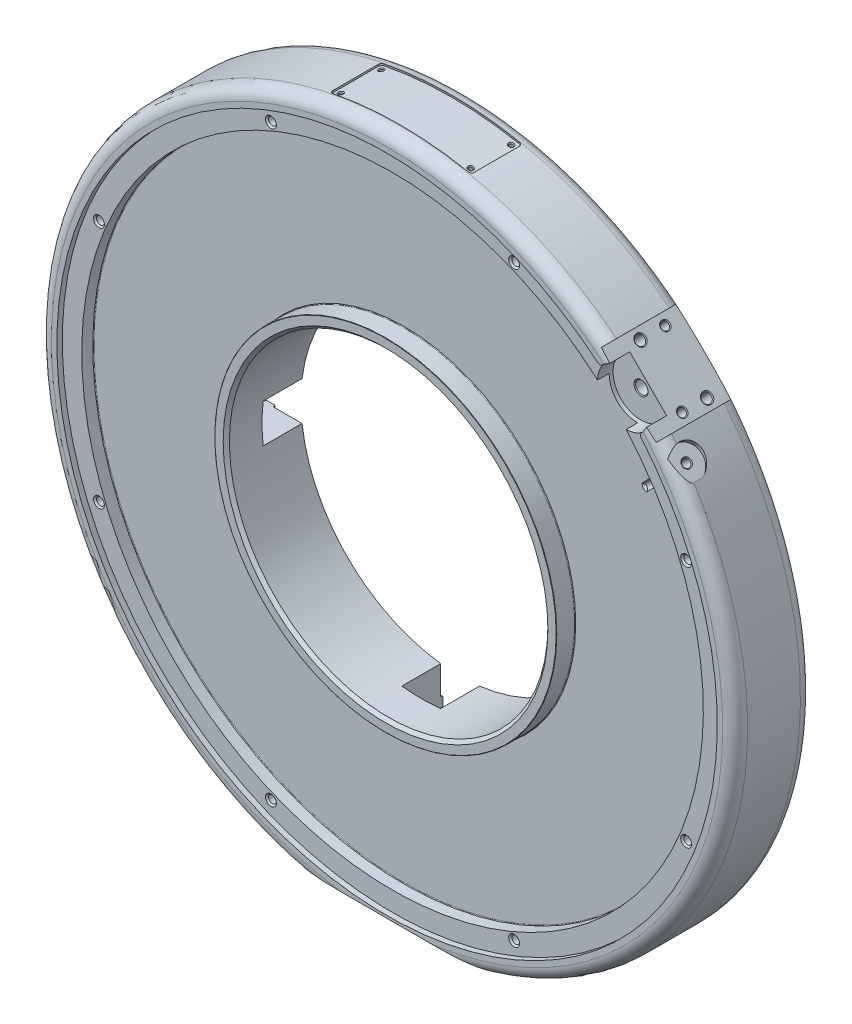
SolidWorks part; units mm, degrees
ref_plane "Plan de face" through (0, 0, 0) normal (0, 0, 1) x (1, 0, 0)
ref_plane "Plan de dessus" through (0, 0, 0) normal (0, 1, 0) x (1, 0, 0)
ref_plane "Plan de droite" through (0, 0, 0) normal (1, 0, 0) x (0, 0, -1)
sketch "Esquisse1" plane through (0, 0, 0) normal (0, 0, 1) x (1, 0, 0)
  circle A0 centre (0, 0) radius 224
  circle A1 centre (0, 0) radius 102.5
  dimension "D1" = 448
  dimension "D2" = 205
extrude "Extrusion1" add sketch "Esquisse1" along normal mid plane 50
sketch "Esquisse2" plane through (0, 0, 25) normal (0, 0, 1) x (1, 0, 0)
  line L0 (0, 0) -> (0, -139.6271) construction
  line L1 (224, -224) -> (-224, -224)
  line L2 (224, -224) -> (224, -214)
  line L3 (224, -214) -> (-224, -214)
  line L4 (-224, -224) -> (-224, -214)
  circle A1 centre (0, 0) radius 224 construction
  dimension "D1" = 10
extrude "Extrusion2" cut sketch "Esquisse2" against normal through all
sketch "Esquisse3" plane through (0, 0, -25) normal (0, 0, -1) x (-1, 0, 0)
  circle A0 centre (0, 0) radius 121
  dimension "D1" = 242
extrude "Extrusion3" cut sketch "Esquisse3" against normal blind 3
sketch "Esquisse4" plane through (0, 0, -25) normal (0, 0, -1) x (-1, 0, 0)
  line L1 (12.5, 0) -> (-12.5, 0)
  line L2 (12.5, 0) -> (12.5, 209)
  line L3 (12.5, 209) -> (-12.5, 209)
  line L4 (-12.5, 0) -> (-12.5, 209)
  dimension "D1" = 25
  dimension "D2" = 209
extrude "Extrusion4" cut sketch "Esquisse4" against normal blind 28
sketch "Esquisse5" plane through (0, 0, -25) normal (0, 0, -1) x (-1, 0, 0)
  line L0 (-12.5, 209) -> (-12.5, 120.3526) construction
  line L1 (12.5, 120.3526) -> (12.5, 209) construction
  line L2 (-12.5, 209) -> (-12.5, 101.7349) construction
  line L3 (12.5, 193) -> (12.5, 209)
  line L4 (-12.5, 209) -> (-12.5, 193)
  arc A0 (-12.5, 209) -> (-12.5, 193) centre (-12.5, 201) ccw
  arc A1 (12.5, 193) -> (12.5, 209) centre (12.5, 201) ccw
  dimension "D1" = 16
extrude "Extrusion5" cut sketch "Esquisse5" against normal up to surface (28 mm away)
pattern_circular "Répétition circulaire1" count 4 over 360 about axis through (0, 0, 0) along (0, 0, 1) of "Extrusion4", "Extrusion5"
hole_wizard "Diamètre du perçage Ø5.0 (5)1" positions "Esquisse7" profile "Esquisse6" hole size "Ø5.0" standard "ISO"
sketch "Esquisse7" plane through (0, 0, -22) normal (0, 0, -1) x (-1, 0, 0)
  line L0 (0, 0) -> (0, 236.799) construction
  line L1 (0, 0) -> (25.107, 113.2503) construction
  circle A0 centre (0, 0) radius 116 construction
  point P0 (25.107, 113.2503)
  point P12 (-25.107, 113.2503)
  dimension "D2" = 232
  dimension "D1" = 12.5
sketch "Esquisse6" plane through (-25.107, 113.2503, -22) normal (1, 0, 0) x (0, 1, 0)
  line L0 (0, 0) -> (0, 20.5022)
  line L1 (0, 20.5022) -> (2.5, 19)
  line L2 (2.5, 19) -> (2.5, 0)
  line L5 (2.5, 0) -> (0, 0)
  line L10 (0, 20.5022) -> (-2.5, 19) construction
  line L11 (0, -6.35) -> (0, 107.95) construction
  dimension "Diamètre du perçage" = 5
  dimension "Profondeur du perçage" = 19
  dimension "Angle de pointe" = 118
chamfer "Chanfrein2" distance 1 angle 45 2 edges at (-27.607, 113.2503, -22) (22.607, 113.2503, -22)
thread "Filetage1" pitch 1 start angle 0, offset 4, length 19, pitch 1, diameter 5
ref_plane "Plan2" through (-22.607, 113.2503, -25) normal (0, -1, 0) x (1, 0, 0)
sketch "Profil de filetage1" plane through (-22.607, 113.2503, -25) normal (0, -1, 0) x (1, 0, 0)
  line L0 (0, 0) -> (0, 1) construction
  line L1 (0, 0) -> (0.5413, 0.3125)
  line L2 (0.5413, 0.3125) -> (0.5413, 0.4375)
  line L3 (0.5413, 0.4375) -> (0, 0.75)
  line L4 (0.5413, 0.375) -> (0, 0.375) construction
  line L11 (0, 0) -> (0, 0.75)
  point P2 (0, 0)
  dimension "Pitch" = 1
  dimension "Profile_Angle" = 60
  dimension "Profile_Land" = 0.125
  dimension "Profile_Height" = 0.5413
thread "Filetage2" pitch 1 start angle 0, offset 4, length 19, pitch 1, diameter 5
ref_plane "Plan3" through (27.607, 113.2503, -25) normal (0, -1, 0) x (1, 0, 0)
sketch "Profil de filetage2" plane through (27.607, 113.2503, -25) normal (0, -1, 0) x (1, 0, 0)
  line L0 (0, 0) -> (0, 1) construction
  line L1 (0, 0) -> (0.5413, 0.3125)
  line L2 (0.5413, 0.3125) -> (0.5413, 0.4375)
  line L3 (0.5413, 0.4375) -> (0, 0.75)
  line L4 (0.5413, 0.375) -> (0, 0.375) construction
  line L11 (0, 0) -> (0, 0.75)
  point P2 (0, 0)
  dimension "Pitch" = 1
  dimension "Profile_Angle" = 60
  dimension "Profile_Land" = 0.125
  dimension "Profile_Height" = 0.5413
pattern_circular "Répétition circulaire2" count 4 over 360 about axis through (0, 0, 0) along (0, 0, 1) of "Diamètre du perçage Ø5.0 (5)1", "Chanfrein2", "Filetage1", "Filetage2"
sketch "Esquisse8" plane through (0, 0, 0) normal (0, 1, 0) x (1, 0, 0)
  line L0 (0, 110.2665) -> (0, -143.8547) construction
  line L1 (-110, -25) -> (-110, -14)
  line L3 (-110, -14) -> (-200, -14)
  line L4 (-200, -14) -> (-200, -21.5)
  line L5 (-200, -21.5) -> (-212.5, -21.5)
  line L6 (-212.5, -21.5) -> (-212.5, -25)
  line L7 (-212.5, -25) -> (-110, -25)
  line L8 (-224, -25) -> (224, -25) construction
  dimension "D1" = 220
  dimension "D2" = 11
  dimension "D3" = 7.5
  dimension "D4" = 400
  dimension "D5" = 425
revolve "Enlèvement de matière-Révolution2" cut sketch "Esquisse8" angle 360 about L0
hole_wizard "Diamètre du perçage Ø5.0 (5)2" positions "Esquisse10" profile "Esquisse9" hole size "Ø5.0" standard "ISO"
sketch "Esquisse10" plane through (0, 0, 21.5) normal (0, 0, 1) x (1, 0, 0)
  line L0 (0, 0) -> (-78.2588, 188.9334) construction
  line L1 (0, 0) -> (0, 240.7135) construction
  circle A0 centre (0, 0) radius 204.5 construction
  point P0 (-78.2588, 188.9334)
  dimension "D2" = 409
  dimension "D1" = 22.5
sketch "Esquisse9" plane through (-78.2588, 188.9334, 21.5) normal (1, 0, 0) x (0, -1, 0)
  line L0 (0, 0) -> (0, 16.5022)
  line L1 (0, 16.5022) -> (2.5, 15)
  line L2 (2.5, 15) -> (2.5, 0)
  line L5 (2.5, 0) -> (0, 0)
  line L10 (0, 16.5022) -> (-2.5, 15) construction
  line L11 (0, -6.35) -> (0, 107.95) construction
  dimension "Diamètre du perçage" = 5
  dimension "Profondeur du perçage" = 15
  dimension "Angle de pointe" = 118
chamfer "Chanfrein3" distance 1 angle 45 1 edges at (-75.7588, 188.9334, 21.5)
thread "Filetage3" pitch 1 start angle 0, offset 4, length 16, pitch 1, diameter 5
ref_plane "Plan4" through (-80.7588, 188.9334, 24.5) normal (0, -1, 0) x (-1, 0, 0)
sketch "Profil de filetage3" plane through (-80.7588, 188.9334, 24.5) normal (0, -1, 0) x (-1, 0, 0)
  line L0 (0, 0) -> (0, 1) construction
  line L1 (0, 0) -> (0.5413, 0.3125)
  line L2 (0.5413, 0.3125) -> (0.5413, 0.4375)
  line L3 (0.5413, 0.4375) -> (0, 0.75)
  line L4 (0.5413, 0.375) -> (0, 0.375) construction
  line L11 (0, 0) -> (0, 0.75)
  point P2 (0, 0)
  dimension "Pitch" = 1
  dimension "Profile_Angle" = 60
  dimension "Profile_Land" = 0.125
  dimension "Profile_Height" = 0.5413
pattern_circular "Répétition circulaire3" count 8 over 360 about axis through (0, 0, 0) along (0, 0, 1) of "Diamètre du perçage Ø5.0 (5)2", "Chanfrein3", "Filetage3"
hole_wizard "Diamètre du perçage Ø8.5 (8.5)1" positions "Esquisse12" profile "Esquisse11" hole size "Ø8.5" standard "ISO"
sketch "Esquisse12" plane through (0, -214, 0) normal (0, -1, 0) x (1, 0, 0)
  line L0 (0, 0) -> (0, -51.1328) construction
  line L2 (-224, -25) -> (224, -25) construction
  point P0 (30, -1)
  point P1 (55, -1)
  point P11 (-55, -1)
  point P12 (-30, -1)
  dimension "D1" = 24
  dimension "D2" = 60
  dimension "D3" = 110
sketch "Esquisse11" plane through (30, -214, -1) normal (1, 0, 0) x (0, 0, -1)
  line L0 (0, 0) -> (0, 27.0537)
  line L1 (0, 27.0537) -> (4.25, 24.5)
  line L2 (4.25, 24.5) -> (4.25, 0)
  line L5 (4.25, 0) -> (0, 0)
  line L10 (0, 27.0537) -> (-4.25, 24.5) construction
  line L11 (0, -6.35) -> (0, 107.95) construction
  dimension "Diamètre du perçage" = 8.5
  dimension "Profondeur du perçage" = 24.5
  dimension "Angle de pointe" = 118
thread "Filetage4" pitch 1.5 start angle 0, offset 4, length 24, pitch 1.5, diameter 8.5
ref_plane "Plan5" through (-50.75, -218, -1) normal (0, 0, 1) x (1, 0, 0)
sketch "Profil de filetage4" plane through (-50.75, -218, -1) normal (0, 0, 1) x (1, 0, 0)
  line L0 (0, 0) -> (0, 1.5) construction
  line L1 (0, 0) -> (0.8119, 0.4687)
  line L2 (0.8119, 0.4687) -> (0.8119, 0.6562)
  line L3 (0.8119, 0.6562) -> (0, 1.125)
  line L4 (0.8119, 0.5625) -> (0, 0.5625) construction
  line L11 (0, 0) -> (0, 1.125)
  point P2 (0, 0)
  dimension "Pitch" = 1.5
  dimension "Profile_Angle" = 60
  dimension "Profile_Land" = 0.1875
  dimension "Profile_Height" = 0.8119
thread "Filetage5" pitch 1.5 start angle 0, offset 4, length 24, pitch 1.5, diameter 8.5
ref_plane "Plan6" through (-25.75, -218, -1) normal (0, 0, 1) x (1, 0, 0)
sketch "Profil de filetage5" plane through (-25.75, -218, -1) normal (0, 0, 1) x (1, 0, 0)
  line L0 (0, 0) -> (0, 1.5) construction
  line L1 (0, 0) -> (0.8119, 0.4687)
  line L2 (0.8119, 0.4687) -> (0.8119, 0.6562)
  line L3 (0.8119, 0.6562) -> (0, 1.125)
  line L4 (0.8119, 0.5625) -> (0, 0.5625) construction
  line L11 (0, 0) -> (0, 1.125)
  point P2 (0, 0)
  dimension "Pitch" = 1.5
  dimension "Profile_Angle" = 60
  dimension "Profile_Land" = 0.1875
  dimension "Profile_Height" = 0.8119
thread "Filetage6" pitch 1.5 start angle 0, offset 4, length 24, pitch 1.5, diameter 8.5
ref_plane "Plan7" through (34.25, -218, -1) normal (0, 0, 1) x (1, 0, 0)
sketch "Profil de filetage6" plane through (34.25, -218, -1) normal (0, 0, 1) x (1, 0, 0)
  line L0 (0, 0) -> (0, 1.5) construction
  line L1 (0, 0) -> (0.8119, 0.4687)
  line L2 (0.8119, 0.4687) -> (0.8119, 0.6562)
  line L3 (0.8119, 0.6562) -> (0, 1.125)
  line L4 (0.8119, 0.5625) -> (0, 0.5625) construction
  line L11 (0, 0) -> (0, 1.125)
  point P2 (0, 0)
  dimension "Pitch" = 1.5
  dimension "Profile_Angle" = 60
  dimension "Profile_Land" = 0.1875
  dimension "Profile_Height" = 0.8119
thread "Filetage7" pitch 1.5 start angle 0, offset 4, length 24, pitch 1.5, diameter 8.5
ref_plane "Plan8" through (59.25, -218, -1) normal (0, 0, 1) x (1, 0, 0)
sketch "Profil de filetage7" plane through (59.25, -218, -1) normal (0, 0, 1) x (1, 0, 0)
  line L0 (0, 0) -> (0, 1.5) construction
  line L1 (0, 0) -> (0.8119, 0.4687)
  line L2 (0.8119, 0.4687) -> (0.8119, 0.6562)
  line L3 (0.8119, 0.6562) -> (0, 1.125)
  line L4 (0.8119, 0.5625) -> (0, 0.5625) construction
  line L11 (0, 0) -> (0, 1.125)
  point P2 (0, 0)
  dimension "Pitch" = 1.5
  dimension "Profile_Angle" = 60
  dimension "Profile_Land" = 0.1875
  dimension "Profile_Height" = 0.8119
chamfer "Chanfrein4" distance 1 angle 45 4 edges at (-55, -214, -5.25) (-30, -214, -5.25) (30, -214, -5.25) (55, -214, -5.25)
fillet "Congé1" radius 8 2 edges at (0, 224, 25) (0, 224, -25)
sketch "Esquisse13" plane through (0, 0, -25) normal (0, 0, -1) x (-1, 0, 0)
  line L2 (-24.5, 193) -> (-24.5, 120.3526)
  line L3 (-24.5, 180.5983) -> (-24.5, 144.294)
  line L5 (-101.7349, 24.5) -> (-193, 24.5)
  line L6 (-144.294, 24.5) -> (-180.5983, 24.5)
  arc A6 (27.9681, -204.0926) -> (-27.9681, -204.0926) centre (0, 0) ccw
  arc A7 (-49.2849, 200.0175) -> (-200.0175, 49.2849) centre (0, 0) ccw
  arc A8 (-24.5, 180.5983) -> (-49.2849, 200.0175) centre (-44.5, 180.5983) ccw
  arc A9 (-13.5331, 130.2991) -> (-130.2991, 13.5331) centre (0, 0) ccw
  arc A10 (-38.606, 125.1822) -> (-125.1822, 38.606) centre (0, 0) ccw
  arc A11 (-38.606, 125.1822) -> (-24.5, 144.294) centre (-44.5, 144.294) ccw
  arc A12 (-125.1822, 38.606) -> (-144.294, 24.5) centre (-144.294, 44.5) cw
  arc A13 (-200.0175, 49.2849) -> (-180.5983, 24.5) centre (-180.5983, 44.5) ccw
  dimension "D5" = 20
  dimension "D1" = 10
  dimension "D2" = 10
  dimension "D3" = 12
  dimension "D4" = 12
extrude "Extrusion6" cut sketch "Esquisse13" against normal blind 24
pattern_circular "Répétition circulaire4" count 4 over 360 about axis through (0, 0, 0) along (0, 0, 1) of "Extrusion6"
sketch "Esquisse27" plane through (0, 0, -1) normal (0, 0, -1) x (-1, 0, 0)
  line L0 (-24.5, 144.294) -> (-24.5, 180.5983) construction
  line L1 (-180.5983, 24.5) -> (-144.294, 24.5) construction
  line L2 (-24.5, 144.294) -> (-24.5, 170.2814) construction
  line L3 (-170.2814, 24.5) -> (-144.294, 24.5) construction
  line L4 (-180.5983, 24.5) -> (-144.294, 24.5) construction
  line L5 (-24.5, 170.2814) -> (-24.5, 180.5983)
  line L6 (-180.5983, 24.5) -> (-170.2814, 24.5)
  arc A1 (-170.2814, 24.5) -> (-189.6315, 49.5568) centre (-170.2814, 44.5) cw
  arc A2 (-46.8925, 190.3079) -> (-190.3079, 46.8925) centre (0, 0) ccw
  arc A3 (-49.5568, 189.6315) -> (-189.6315, 49.5568) centre (0, 0) ccw
  arc A4 (-49.5568, 189.6315) -> (-24.5, 170.2814) centre (-44.5, 170.2814) cw
  arc A5 (-24.5, 180.5983) -> (-49.2849, 200.0175) centre (-44.5, 180.5983) ccw construction
  arc A6 (-49.2849, 200.0175) -> (-200.0175, 49.2849) centre (0, 0) ccw construction
  arc A7 (-200.0175, 49.2849) -> (-180.5983, 24.5) centre (-180.5983, 44.5) ccw construction
  arc A8 (-24.5, 180.5983) -> (-49.2849, 200.0175) centre (-44.5, 180.5983) ccw
  arc A9 (-49.2849, 200.0175) -> (-200.0175, 49.2849) centre (0, 0) ccw
  arc A10 (-200.0175, 49.2849) -> (-180.5983, 24.5) centre (-180.5983, 44.5) ccw
  dimension "D2" = 20
  dimension "D1" = 10
extrude "Extrusion14" add sketch "Esquisse27" along normal up to surface (24 mm away)
sketch "Esquisse15" plane through (0, 0, 14) normal (0, 0, 1) x (1, 0, 0)
  line L0 (136.8252, 172.1805) -> (172.1805, 136.8252)
  line L1 (159.8061, 159.8061) -> (0, 0) construction
  line L2 (136.8252, 172.1805) -> (140.7142, 176.0696)
  line L3 (172.1805, 136.8252) -> (176.0696, 140.7142)
  line L4 (140.7142, 176.0696) -> (176.0696, 140.7142)
  line L5 (139.1673, 188.9303) -> (191.6809, 136.4166) construction
  line L6 (0, 0) -> (0, 53.5826) construction
  circle A1 centre (0, 0) radius 197 construction
  circle A2 centre (149.9066, 149.9066) radius 15 construction
  circle A3 centre (164.0488, 164.0488) radius 5
  arc A4 (66.1816, -214) -> (-66.1816, -214) centre (0, 0) ccw construction
  dimension "D1" = 50
  dimension "D3" = 30
  dimension "D4" = 394
  dimension "D5" = 10
  dimension "D2" = 13.5
  dimension "D6" = 45
extrude "Extrusion8" cut sketch "Esquisse15" against normal through all and the other way through all
sketch "Esquisse16" plane through (0, 0, -25) normal (0, 0, -1) x (-1, 0, 0)
  circle A0 centre (0, 0) radius 211.25
  circle A1 centre (0, 0) radius 127
  dimension "D1" = 422.5
  dimension "D2" = 254
extrude "Extrusion9" cut sketch "Esquisse16" against normal blind 2.9
sketch "Esquisse17" plane through (0, 0, -25) normal (0, 0, -1) x (-1, 0, 0)
  circle A0 centre (0, 0) radius 127
  arc A1 (126.3833, 12.5) -> (12.5, 126.3833) centre (0, 0) ccw construction
extrude "Extrusion10" cut sketch "Esquisse17" against normal blind 1.5
chamfer "Chanfrein6" distance 0.5 angle 45 7 edges at (89.8026, -89.8026, -23.5) (85.5599, -85.5599, -23.5) (-89.8026, -89.8026, -23.5) (-85.5599, -85.5599, -23.5) (-85.5599, 85.5599, -23.5) (-89.8026, 89.8026, -23.5) (85.5599, 85.5599, -23.5)
fillet "Congé2" radius 0.4 9 edges at (-85.5599, 85.5599, -22) (-85.5599, -85.5599, -22) (85.5599, -85.5599, -22) (85.5599, 85.5599, -22) (-211.25, 0, -22.1) (89.8026, 89.8026, -22.1) (-89.8026, 89.8026, -23) (-89.8026, -89.8026, -22.1) (89.8026, -89.8026, -22.1)
sketch "Esquisse18" plane through (0, 0, 25) normal (0, 0, 1) x (1, 0, 0)
  circle A0 centre (149.9066, 149.9066) radius 18
  dimension "D1" = 36
extrude "Extrusion11" cut sketch "Esquisse18" against normal blind 13.5 and the other way through all
sketch "Esquisse19" plane through (0, 0, 11.5) normal (0, 0, 1) x (1, 0, 0)
  circle A0 centre (149.9066, 149.9066) radius 4
  dimension "D1" = 8
extrude "Extrusion12" cut sketch "Esquisse19" against normal through all
chamfer "Chanfrein7" distance 0.5 angle 45 8 edges at (149.5115, 153.8871, -25) (153.8871, 149.5115, -25) (152.1238, 146.5773, -23.75) (146.5773, 152.1238, -23.75) (152.0216, 146.5115, -22.215) (146.5303, 152.0514, -22.2538) (147.0782, 147.0782, -22.1) (153.9066, 149.9066, 11.5)
hole_wizard "Diamètre du perçage Ø5.0 (5)3" positions "Esquisse21" profile "Esquisse20" hole size "Ø5.0" standard "ISO"
sketch "Esquisse21" plane through (154.5028, 154.5028, 0) normal (0.7071, 0.7071, 0) x (0, 0, -1)
  line L0 (0, 0) -> (-38.0916, 0) construction
  line L1 (-11.5, -16.7854) -> (-11.5, 16.7854) construction
  line L2 (23.9707, 25) -> (-23.9707, 25) construction
  line L3 (23.9707, -25) -> (-23.9707, -25) construction
  point P0 (13, 19)
  point P1 (-3, -19)
  dimension "D1" = 38
  dimension "D2" = 38
  dimension "D3" = 8.5
  dimension "D4" = 16
sketch "Esquisse20" plane through (141.0678, 167.9379, -13) normal (0, 0, 1) x (-0.7071, 0.7071, 0)
  line L0 (0, 0) -> (0, 24.5022)
  line L1 (0, 24.5022) -> (2.5, 23)
  line L2 (2.5, 23) -> (2.5, 0)
  line L5 (2.5, 0) -> (0, 0)
  line L10 (0, 24.5022) -> (-2.5, 23) construction
  line L11 (0, -6.35) -> (0, 107.95) construction
  dimension "Diamètre du perçage" = 5
  dimension "Profondeur du perçage" = 23
  dimension "Angle de pointe" = 118
hole_wizard "Dégagement M131" positions "Esquisse23" profile "Esquisse22" hole size "M13" standard "Ansi Metric"
sketch "Esquisse23" plane through (154.5028, 154.5028, 0) normal (0.7071, 0.7071, 0) x (0, 0, -1)
  line L0 (13, 19) -> (-66.8694, 19) construction
  line L1 (13, 19) -> (13, -40.002) construction
  line L2 (-3, -19) -> (44.0998, -19) construction
  line L3 (-3, -19) -> (-3, 46.1137) construction
  point P0 (-3, 19)
  point P15 (13, -19)
sketch "Esquisse22" plane through (141.0678, 167.9379, 3) normal (0, 0, 1) x (-0.7071, 0.7071, 0)
  line L0 (0, 0) -> (0, 21.8026)
  line L1 (0, 21.8026) -> (3, 20)
  line L2 (3, 20) -> (3, 0)
  line L5 (3, 0) -> (0, 0)
  line L10 (0, 21.8026) -> (-3, 20) construction
  line L11 (0, -6.35) -> (0, 107.95) construction
  dimension "Diamètre du perçage" = 6
  dimension "Profondeur du perçage" = 20
  dimension "Angle de pointe" = 118
chamfer "Chanfrein8" distance 0.5 angle 45 4 edges at (166.1701, 142.8356, 3) (165.8165, 143.1891, -13) (139.3, 169.7056, -13) (138.9465, 170.0592, 3)
thread "Filetage10" pitch 1 start angle 0, offset 4.5, length 24, pitch 1, diameter 5
ref_plane "Plan11" through (143.8962, 170.7663, -10.5) normal (0.7071, -0.7071, 0) x (0, 0, 1)
sketch "Profil de filetage10" plane through (143.8962, 170.7663, -10.5) normal (0.7071, -0.7071, 0) x (0, 0, 1)
  line L0 (0, 0) -> (0, 1) construction
  line L1 (0, 0) -> (0.5413, 0.3125)
  line L2 (0.5413, 0.3125) -> (0.5413, 0.4375)
  line L3 (0.5413, 0.4375) -> (0, 0.75)
  line L4 (0.5413, 0.375) -> (0, 0.375) construction
  line L11 (0, 0) -> (0, 0.75)
  point P2 (0, 0)
  dimension "Pitch" = 1
  dimension "Profile_Angle" = 60
  dimension "Profile_Land" = 0.125
  dimension "Profile_Height" = 0.5413
thread "Filetage11" pitch 1 start angle 0, offset 4.5, length 24, pitch 1, diameter 5
ref_plane "Plan12" through (170.7663, 143.8962, 5.5) normal (0.7071, -0.7071, 0) x (0, 0, 1)
sketch "Profil de filetage11" plane through (170.7663, 143.8962, 5.5) normal (0.7071, -0.7071, 0) x (0, 0, 1)
  line L0 (0, 0) -> (0, 1) construction
  line L1 (0, 0) -> (0.5413, 0.3125)
  line L2 (0.5413, 0.3125) -> (0.5413, 0.4375)
  line L3 (0.5413, 0.4375) -> (0, 0.75)
  line L4 (0.5413, 0.375) -> (0, 0.375) construction
  line L11 (0, 0) -> (0, 0.75)
  point P2 (0, 0)
  dimension "Pitch" = 1
  dimension "Profile_Angle" = 60
  dimension "Profile_Land" = 0.125
  dimension "Profile_Height" = 0.5413
sketch "Esquisse24" plane through (154.5028, 154.5028, 0) normal (0.7071, 0.7071, 0) x (0, 0, -1)
  line L0 (-17, -25) -> (-17, -224) construction
  circle A0 centre (-15, -40) radius 10
  dimension "D1" = 40
  dimension "D2" = 20
  dimension "D3" = 2
extrude "Extrusion13" cut sketch "Esquisse24" along normal through all
hole_wizard "Diamètre du perçage Ø5.0 (5)4" positions "Esquisse26" profile "Esquisse25" hole size "Ø5.0" standard "ISO"
sketch "Esquisse26" plane through (154.5028, 154.5028, 0) normal (0.7071, 0.7071, 0) x (0, 0, -1)
  arc A0 (-11.4092, -49.3331) -> (-23.1183, -34.161) centre (-15, -40) ccw construction
  point P0 (-15, -40)
sketch "Esquisse25" plane through (182.7871, 126.2186, 15) normal (0, 0, 1) x (-0.7071, 0.7071, 0)
  line L0 (0, 0) -> (0, 41.5022)
  line L1 (0, 41.5022) -> (2.5, 40)
  line L2 (2.5, 40) -> (2.5, 0)
  line L5 (2.5, 0) -> (0, 0)
  line L10 (0, 41.5022) -> (-2.5, 40) construction
  line L11 (0, -6.35) -> (0, 107.95) construction
  dimension "Diamètre du perçage" = 5
  dimension "Profondeur du perçage" = 40
  dimension "Angle de pointe" = 118
chamfer "Chanfrein9" distance 0.5 angle 45 1 edges at (181.0193, 127.9863, 15)
thread "Filetage12" pitch 1 start angle 0, offset 4.5, length 16.5, pitch 1, diameter 5
ref_plane "Plan13" through (185.6155, 129.047, 17.5) normal (0.7071, -0.7071, 0) x (0, 0, 1)
sketch "Profil de filetage12" plane through (185.6155, 129.047, 17.5) normal (0.7071, -0.7071, 0) x (0, 0, 1)
  line L0 (0, 0) -> (0, 1) construction
  line L1 (0, 0) -> (0.5413, 0.3125)
  line L2 (0.5413, 0.3125) -> (0.5413, 0.4375)
  line L3 (0.5413, 0.4375) -> (0, 0.75)
  line L4 (0.5413, 0.375) -> (0, 0.375) construction
  line L11 (0, 0) -> (0, 0.75)
  point P2 (0, 0)
  dimension "Pitch" = 1
  dimension "Profile_Angle" = 60
  dimension "Profile_Land" = 0.125
  dimension "Profile_Height" = 0.5413
fillet "Congé3" radius 2 2 edges at (136.9937, 162.4468, 23.25) (162.4468, 136.9937, 23.25)
fillet "Congé4" radius 0.4 3 edges at (158.2464, 122.3032, 14) (-151.4833, -130.5865, 14) (-110, 0, 14)
sketch "Esquisse28" plane through (0, 0, 0) normal (0, 0, 1) x (1, 0, 0)
  line L0 (-45.75, 220.2997) -> (-45.3433, 218.3414)
  line L1 (45.75, 220.2997) -> (45.3433, 218.3414)
  line L2 (0, 223) -> (0, 0) construction
  arc A0 (-45.3433, 218.3414) -> (45.3433, 218.3414) centre (0, 0) cw
  arc A1 (-45.75, 220.2997) -> (45.75, 220.2997) centre (0, 0) cw
  dimension "D3" = 223
  dimension "D2" = 91.5
  dimension "D1" = 2
extrude "Enlèv. mat.-Extru.1" cut sketch "Esquisse28" against normal mid plane 33
fillet "Congé5" radius 2 4 edges at (45.445, 218.831, -16.5) (45.445, 218.831, 16.5) (-45.445, 218.831, 16.5) (-45.445, 218.831, -16.5)
sketch "Esquisse29" plane through (0, 0, 25) normal (0, 0, 1) x (1, 0, 0)
  circle A0 centre (0, 0) radius 102.5 construction
  circle A1 centre (0, 0) radius 110
  circle A2 centre (0, 0) radius 110
  circle A3 centre (0, 0) radius 102.5
  dimension "D1" = 0
extrude "Boss.-Extru.1" add sketch "Esquisse29" along normal blind 1
chamfer "Chanfrein10" distance 0.2 angle 45 1 edges at (110, 0, 26)
chamfer "Chanfrein11" distance 2 angle 45 1 edges at (102.5, 0, 26)
ref_plane "Plan1" through (-41.8243, 219.0428, 0) normal (-0.1876, 0.9823, 0) x (-0.9823, -0.1876, 0)
hole_wizard "Diamètre du perçage Ø3.5 (3.5)1" positions "Esquisse32" profile "Esquisse31" hole size "Ø3.5" standard "DIN"
sketch "Esquisse32" plane through (-41.8243, 219.0428, 0) normal (-0.1876, 0.9823, 0) x (-0.9823, -0.1876, 0)
  line L0 (0, 13) -> (0, -13) construction
  point P1 (0, 13)
  point P3 (0, -13)
  dimension "D1" = 26
sketch "Esquisse31" plane through (-41.8243, 219.0428, 13) normal (0, 0, 1) x (-0.9823, -0.1876, 0)
  line L0 (0, 0) -> (0, 9.2511)
  line L1 (0, 9.2511) -> (1.25, 8.5)
  line L2 (1.25, 8.5) -> (1.25, 0)
  line L5 (1.25, 0) -> (0, 0)
  line L10 (0, 9.2511) -> (-1.25, 8.5) construction
  line L11 (0, -6.35) -> (0, 107.95) construction
  dimension "Diamètre du perçage" = 2.5
  dimension "Profondeur du perçage" = 8.5
  dimension "Angle de pointe" = 118
chamfer "Chanfrein12" distance 0.5 angle 45 2 edges at (-40.6287, 219.2677, -12.7125) (-40.6287, 219.2677, 13.2875)
mirror "Symétrie1" about plane through (0, 0, 0) normal (1, 0, 0) of "Chanfrein12", "Diamètre du perçage Ø3.5 (3.5)1"
